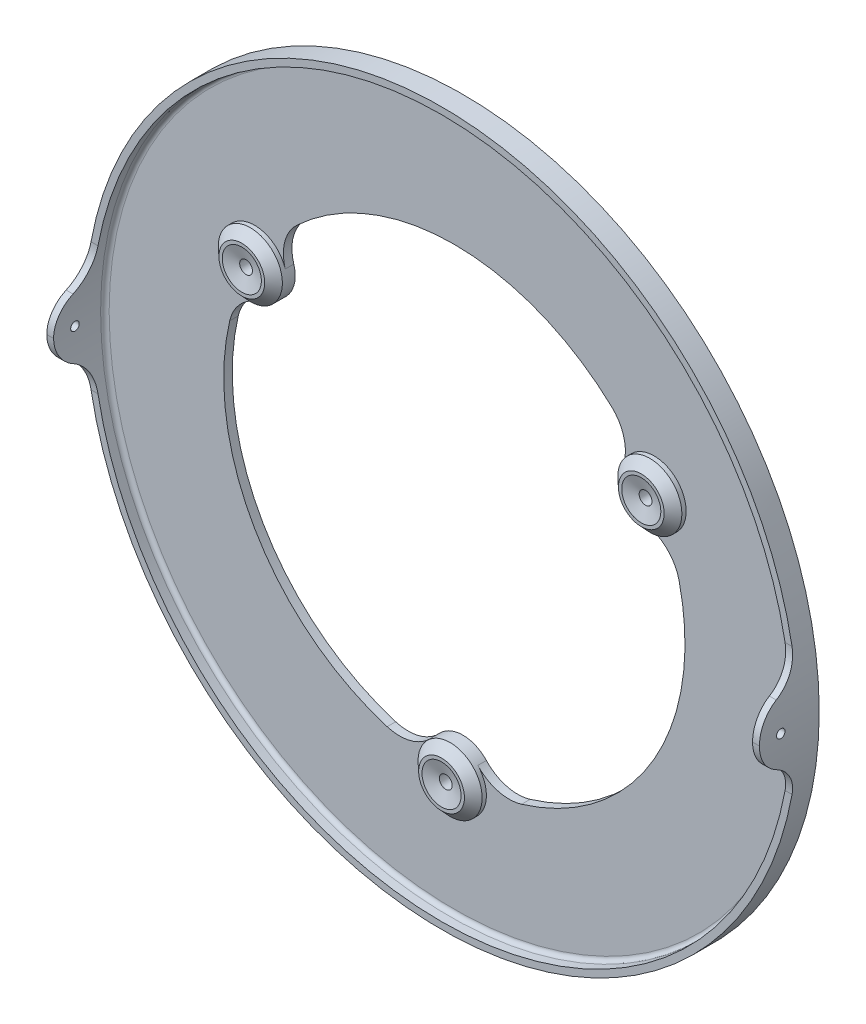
SolidWorks part; units mm, degrees
ref_plane "Спереди" through (0, 0, 0) normal (0, 0, 1) x (1, 0, 0)
ref_plane "Сверху" through (0, 0, 0) normal (0, 1, 0) x (1, 0, 0)
ref_plane "Справа" through (0, 0, 0) normal (1, 0, 0) x (0, 0, -1)
sketch "Эскиз1" plane through (0, 0, 0) normal (0, 0, 1) x (1, 0, 0)
  circle A1 centre (-46.75, 26.9911) radius 1.5
  circle A2 centre (46.75, 26.9911) radius 1.5
  circle A3 centre (0, -53.9823) radius 1.5
  circle A4 centre (0, 0) radius 85
  arc A5 (-50.0397, 20.2511) -> (-42.5579, 33.2101) centre (-46.75, 26.9911) ccw
  arc A6 (42.5579, 33.2101) -> (50.0397, 20.2511) centre (46.75, 26.9911) ccw
  arc A7 (7.4819, -53.4612) -> (-7.4819, -53.4612) centre (0, -53.9823) ccw
  arc A8 (-50.0397, 20.2511) -> (-7.4819, -53.4612) centre (0, 0) ccw
  arc A10 (42.5579, 33.2101) -> (-42.5579, 33.2101) centre (0, 0) ccw
  arc A11 (7.4819, -53.4612) -> (50.0397, 20.2511) centre (0, 0) ccw
  dimension "D4" = 3
  dimension "D5" = 3
  dimension "D6" = 3
  dimension "D7" = 15
  dimension "D8" = 15
  dimension "D9" = 15
  dimension "D10" = 170
  dimension "D1" = 93.5
  dimension "D2" = 93.5
  dimension "D3" = 93.5
extrude "Бобышка-Вытянуть1" add sketch "Эскиз1" along normal blind 2
sketch "Эскиз2" plane through (0, 0, 2) normal (0, 0, 1) x (1, 0, 0)
  circle A0 centre (0, 0) radius 83.4
  circle A1 centre (0, 0) radius 85 construction
  circle A2 centre (0, 0) radius 81.8
  dimension "D1" = 1.6
  dimension "D2" = 1.6
extrude "Бобышка-Вытянуть2" add sketch "Эскиз2" along normal blind 12
sketch "Эскиз3" plane through (0, 0, 0) normal (1, 0, 0) x (0, 0, -1)
  line L0 (-14, 83.4) -> (-14, 15) construction
  line L1 (-14, 83.4) -> (-14, -83.4) construction
  line L2 (-5, 83.4) -> (-5, 15)
  line L3 (-23, 83.4) -> (-23, 15)
  line L4 (-14, -83.4) -> (-14, -15) construction
  line L5 (-23, -83.4) -> (-23, -15)
  line L6 (-5, -83.4) -> (-5, -15)
  line L7 (-2, 83.4) -> (-2, -83.4) construction
  line L8 (0, -85) -> (0, 85) construction
  arc A0 (-5, 83.4) -> (-23, 83.4) centre (-14, 83.4) ccw
  arc A1 (-23, 15) -> (-5, 15) centre (-14, 15) ccw
  arc A2 (-23, -83.4) -> (-5, -83.4) centre (-14, -83.4) ccw
  arc A3 (-5, -15) -> (-23, -15) centre (-14, -15) ccw
  circle A4 centre (-9, 0) radius 1
  point P5 (-14, 49.2)
  point P10 (-14, -49.2)
  dimension "D5" = 2
  dimension "D1" = 30
  dimension "D2" = 15
  dimension "D3" = 18
  dimension "D4" = 18
  dimension "D6" = 7
extrude "Вырез-Вытянуть1" cut sketch "Эскиз3" against normal through all both and the other way through all
fillet "Скругление1" radius 8 4 edges at (-82.3818, 6, 14) (82.3818, 6, 14) (82.3818, -6, 14) (-82.3818, -6, 14)
fillet "Скругление2" radius 1 1 edges at (81.8, 0, 2)
sketch "Эскиз4" plane through (0, 0, 2) normal (0, 0, 1) x (1, 0, 0)
  circle A0 centre (-46.75, 26.9911) radius 7.5
  circle A1 centre (46.75, 26.9911) radius 7.5
  circle A2 centre (0, -53.9823) radius 7.5
  circle A3 centre (-46.75, 26.9911) radius 1.5 construction
  circle A4 centre (-46.75, 26.9911) radius 1.5
  circle A5 centre (46.75, 26.9911) radius 1.5
  circle A6 centre (0, -53.9823) radius 1.5
  point P9 (0, 0)
  point P17 (0, 0)
  dimension "D1" = 3
  dimension "D2" = 3
extrude "Бобышка-Вытянуть3" add sketch "Эскиз4" along normal blind 3
chamfer "Фаска1" distance 1 angle 72 3 edges at (1.5, -53.9823, 5) (48.25, 26.9911, 5) (-45.25, 26.9911, 5)
chamfer "Фаска2" distance 2 angle 47 3 edges at (7.5, -53.9823, 5) (54.25, 26.9911, 5) (-39.25, 26.9911, 5)
sketch "Эскиз7" plane through (0, 0, 2) normal (0, 0, 1) x (1, 0, 0)
  circle A0 centre (0, 0) radius 83.4 construction
  circle A1 centre (0, 0) radius 85
  circle A2 centre (0, 0) radius 85
  circle A3 centre (0, 0) radius 83.4
  dimension "D1" = 0
extrude "Вырез-Вытянуть3" cut sketch "Эскиз7" against normal through all both and the other way through all
fillet "Скругление3" radius 10 6 edges at (7.4819, -53.4612, 1) (-7.4819, -53.4612, 1) (42.5579, 33.2101, 1) (50.0397, 20.2511, 1) (-50.0397, 20.2511, 1) (-42.5579, 33.2101, 1)
